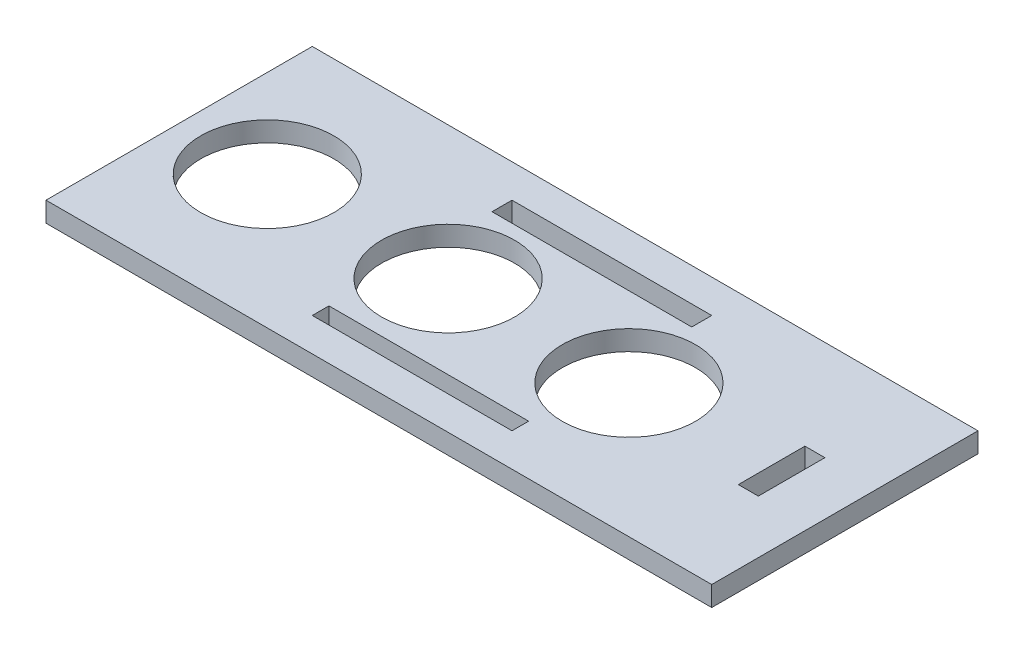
SolidWorks part; units mm, degrees
ref_plane "Alzado" through (0, 0, 0) normal (0, 0, 1) x (1, 0, 0)
ref_plane "Planta" through (0, 0, 0) normal (0, 1, 0) x (1, 0, 0)
ref_plane "Vista lateral" through (0, 0, 0) normal (1, 0, 0) x (0, 0, -1)
sketch "Sketch1" plane through (0, 0, 0) normal (0, 1, 0) x (1, 0, 0)
  line L0 (-50, 0) -> (50, 0) construction
  line L1 (50, -20) -> (-50, -20)
  line L2 (50, -20) -> (50, 20)
  line L3 (50, 20) -> (-50, 20)
  line L4 (-50, -20) -> (-50, 20)
  line L7 (15, 12) -> (-15, 12)
  line L8 (15, 12) -> (15, 15)
  line L9 (15, 15) -> (-15, 15)
  line L10 (-15, 12) -> (-15, 15)
  line L13 (15, -12.5) -> (15, -15)
  line L14 (15, -15) -> (-15, -15)
  line L15 (15, -12.5) -> (-15, -12.5)
  line L16 (-15, -12.5) -> (-15, -15)
  line L18 (39, -5) -> (42, -5)
  line L19 (39, -5) -> (39, 5)
  line L20 (39, 5) -> (42, 5)
  line L21 (42, -5) -> (42, 5)
  circle A0 centre (-36.76, 0) radius 10
  circle A1 centre (-9.6, 0) radius 10
  circle A2 centre (17.56, 0) radius 10
  point P0 (0, 0)
  point P6 (0, 13.75)
  point P19 (40.75, 0)
extrude "Boss-Extrude1" add sketch "Sketch1" along normal blind 3
equation "\"D3@Sketch1\"=5"
equation "\"kerf\" = 0.24"
equation "\"mwk\"= \"mw\" + \"kerf\""
equation "\"D6@Sketch1\"=\"mw\""
equation "\"D8@Sketch1\"=10+\"mwk\""
equation "\"mw\" = 3mm"
equation "\"D11@Sketch1\"=\"mw\""
equation "\"D1@Boss-Extrude1\"=\"mw\""
